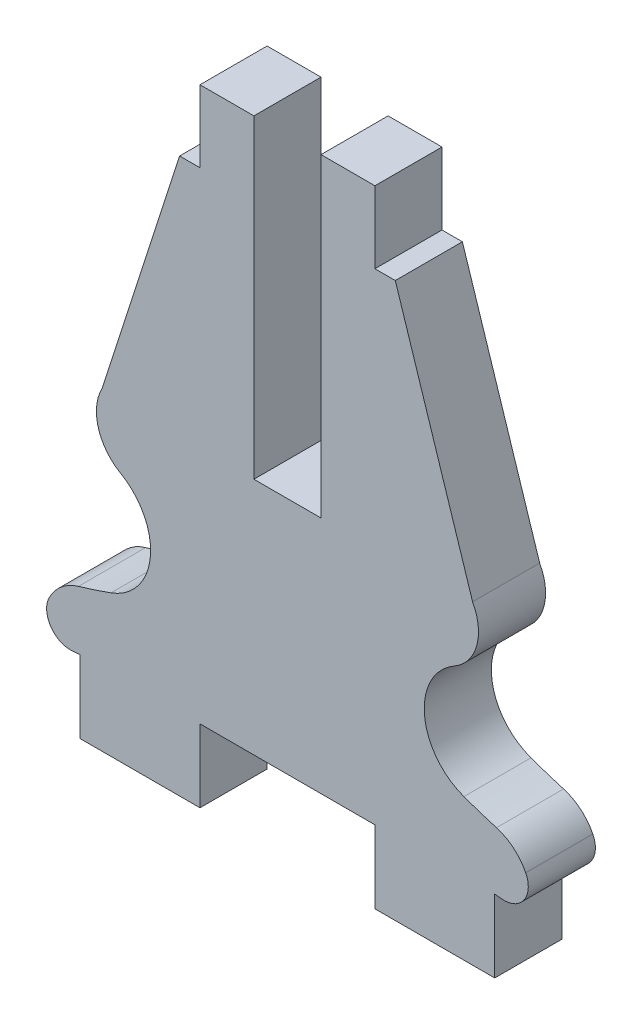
SolidWorks part; units mm, degrees
ref_plane "Front Plane" through (0, 0, 0) normal (0, 0, 1) x (1, 0, 0)
ref_plane "Top Plane" through (0, 0, 0) normal (0, 1, 0) x (1, 0, 0)
ref_plane "Right Plane" through (0, 0, 0) normal (1, 0, 0) x (0, 0, -1)
sketch "Sketch1" plane through (0, 0, 0) normal (0, 0, 1) x (1, 0, 0)
  line L0 (0, -15) -> (0, 35) construction
  line L11 (-8.65, 0.0356) -> (-8.9484, 0.0052)
  line L12 (-3.65, 0.0356) -> (-3.65, -3)
  line L14 (-8.65, -3) -> (-8.65, 0.0356)
  line L15 (-3.65, -3) -> (-8.65, -3)
  line L17 (-7.7265, 10.1319) -> (-4.5, 20.1319)
  line L20 (7.7265, 10.1319) -> (4.5, 20.1319)
  line L22 (3.65, -3) -> (8.65, -3)
  line L23 (8.65, -3) -> (8.65, 0.0356)
  line L25 (3.65, 0.0356) -> (3.65, -3)
  line L26 (8.65, 0.0356) -> (8.9484, 0.0052)
  line L31 (-21.5642, 0) -> (20.7966, 0) construction
  line L32 (-4.5, 20.1319) -> (-3.65, 20.1319)
  line L33 (-3.65, 20.1319) -> (-3.65, 23.1319)
  line L34 (-3.65, 23.1319) -> (-1.4, 23.1319)
  line L35 (3.65, 23.1319) -> (3.65, 20.1319)
  line L36 (3.65, 20.1319) -> (4.5, 20.1319)
  line L37 (-3.65, 0.0356) -> (3.65, 0.0356)
  line L38 (-1.4, 23.1319) -> (-1.4, 10)
  line L39 (-1.4, 10) -> (1.4, 10)
  line L40 (1.4, 10) -> (1.4, 23.1319)
  line L41 (1.4, 23.1319) -> (3.65, 23.1319)
  arc A6 (-7.3625, 2.9132) -> (-6.9664, 7.4352) centre (-8.2086, 5.2657) ccw
  arc A7 (-8.7226, 2.4685) -> (-7.3625, 2.9132) centre (-15.6391, 25.924) ccw
  arc A8 (-9.9431, 1.4498) -> (-8.7226, 2.4685) centre (-8.1569, 0.5502) cw
  arc A9 (-8.9484, 0.0052) -> (-9.9431, 1.4498) centre (-9.05, 1) cw
  arc A10 (-6.9664, 7.4352) -> (-7.7265, 10.1319) centre (-5.9726, 9.1708) cw
  arc A11 (6.9664, 7.4352) -> (7.7265, 10.1319) centre (5.9726, 9.1708) ccw
  arc A12 (8.9484, 0.0052) -> (9.9431, 1.4498) centre (9.05, 1) ccw
  arc A13 (9.9431, 1.4498) -> (8.7226, 2.4685) centre (8.1569, 0.5502) ccw
  arc A14 (8.7226, 2.4685) -> (7.3625, 2.9132) centre (15.6391, 25.924) cw
  arc A15 (7.3625, 2.9132) -> (6.9664, 7.4352) centre (8.2086, 5.2657) cw
  point P14 (0, 10)
  point P39 (0, 24.4759)
extrude "Boss-Extrude1" add sketch "Sketch1" along normal blind 2.8
equation "\"mdf\" = 3mm - \"kerf\"'chess table material"
equation "\"diameter\"= ( 25mm - 5mm )'diameter of all of the pieces in relation with the chess table"
equation "\"size press fit\"= 5mm"
equation "\"gap\" = ( ( \"diameter\" - ( \"size press fit\" * 3 ) ) / 4mm ) + \"kerf\""
equation "\"gap press fit\" = ( \"diameter\" - \"size press fit\" - \"size press fit\" - \"gap\" - \"gap\" ) + \"kerf\""
equation "\"D1@Boss-Extrude1\"=\"mdf\""
equation "\"gap y\"= \"gap\" + 1mm"
equation "\"kerf\"= 0.2"
equation "\"D18@Sketch1\"=\"gap press fit\""
equation "\"D4@Sketch1\"=\"size press fit\""
equation "\"D14@Sketch1\"=\"mdf\""
